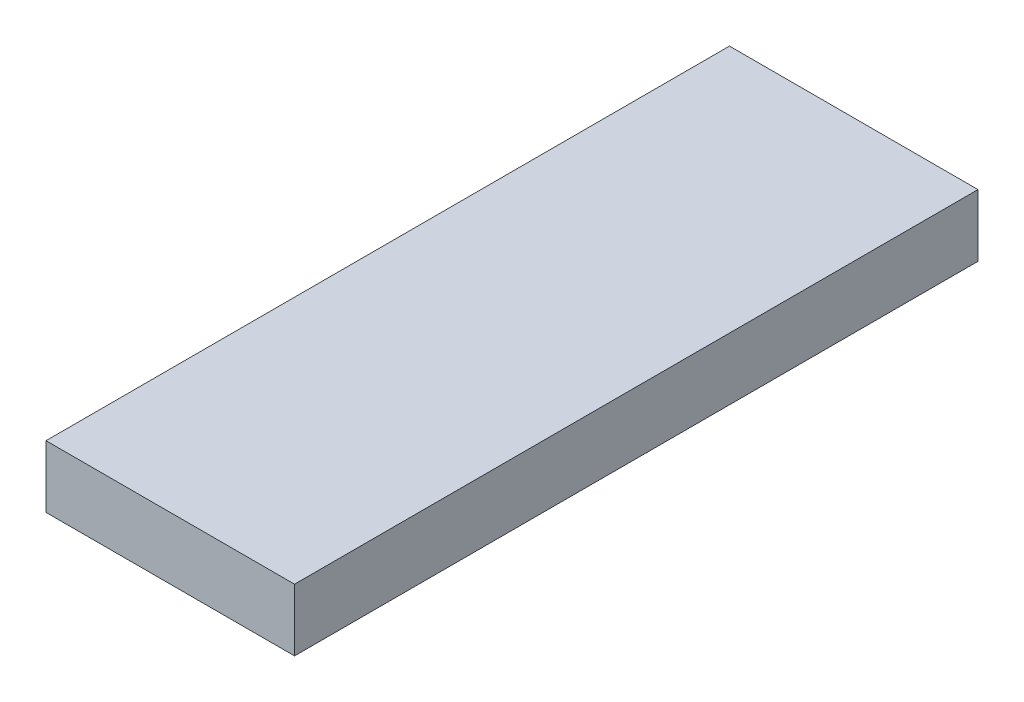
SolidWorks part; units mm, degrees
ref_plane "Front Plane" through (0, 0, 0) normal (0, 0, 1) x (1, 0, 0)
ref_plane "Top Plane" through (0, 0, 0) normal (0, 1, 0) x (1, 0, 0)
ref_plane "Right Plane" through (0, 0, 0) normal (1, 0, 0) x (0, 0, -1)
sketch "Sketch1" plane through (0, 0, 0) normal (0, 1, 0) x (1, 0, 0)
  line L0 (0, 0) -> (50.8, 0)
  line L1 (0, 0) -> (0, 139.7)
  line L2 (50.8, 0) -> (50.8, 139.7)
  line L3 (0, 139.7) -> (50.8, 139.7)
  dimension "D1" = 50.8
  dimension "D2" = 139.7
extrude "Boss-Extrude1" add sketch "Sketch1" along normal blind 12.7
